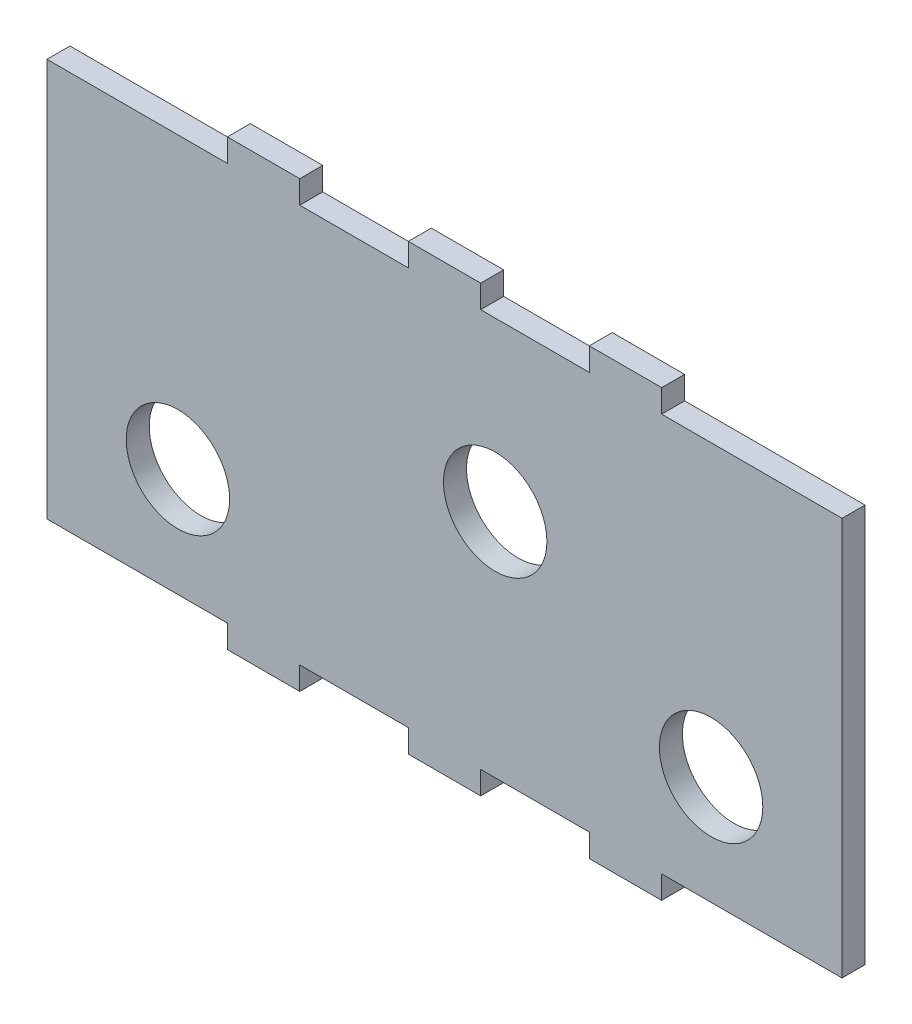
SolidWorks part; units mm, degrees
ref_plane "Front Plane" through (0, 0, 0) normal (0, 0, 1) x (1, 0, 0)
ref_plane "Top Plane" through (0, 0, 0) normal (0, 1, 0) x (1, 0, 0)
ref_plane "Right Plane" through (0, 0, 0) normal (1, 0, 0) x (0, 0, -1)
sketch "Sketch1" plane through (0, 0, 0) normal (0, 0, 1) x (1, 0, 0)
  line L0 (36.18, 30) -> (183.5, 30) construction
  line L5 (123.8464, 30) -> (183.5, 30) construction
  line L6 (123.8464, 63.6704) -> (123.8464, 30) construction
  line L7 (123.8464, 30) -> (36.18, 30) construction
  line L8 (21.8925, 0) -> (21.8925, 110) construction
  line L9 (0, 94.1504) -> (219.68, 94.1504) construction
  line L10 (197.7875, 0) -> (197.7875, 110) construction
  line L11 (109.84, 30) -> (109.84, 0) construction
  line L12 (99.84, 0) -> (99.84, -6.35)
  line L13 (0, 0) -> (219.68, 0) construction
  line L14 (0, 0) -> (0, 110)
  line L15 (0, 110) -> (219.68, 110) construction
  line L16 (219.68, 0) -> (219.68, 110)
  line L17 (99.84, -6.35) -> (119.84, -6.35)
  line L18 (119.84, -6.35) -> (119.84, 0)
  line L19 (99.84, 0) -> (69.84, 0)
  line L20 (69.84, 0) -> (69.84, -6.35)
  line L21 (69.84, -6.35) -> (49.84, -6.35)
  line L22 (49.84, -6.35) -> (49.84, 0)
  line L23 (49.84, 0) -> (0, 0)
  line L24 (119.84, 0) -> (149.84, 0)
  line L25 (149.84, 0) -> (149.84, -6.35)
  line L26 (149.84, -6.35) -> (169.84, -6.35)
  line L27 (169.84, -6.35) -> (169.84, 0)
  line L28 (169.84, 0) -> (219.68, 0)
  line L29 (0, 55) -> (219.68, 55) construction
  line L30 (169.84, 110) -> (219.68, 110)
  line L31 (169.84, 116.35) -> (169.84, 110)
  line L32 (149.84, 116.35) -> (169.84, 116.35)
  line L33 (149.84, 110) -> (149.84, 116.35)
  line L34 (119.84, 110) -> (149.84, 110)
  line L35 (119.84, 116.35) -> (119.84, 110)
  line L36 (99.84, 116.35) -> (119.84, 116.35)
  line L37 (99.84, 110) -> (99.84, 116.35)
  line L38 (99.84, 110) -> (69.84, 110)
  line L39 (69.84, 110) -> (69.84, 116.35)
  line L40 (69.84, 116.35) -> (49.84, 116.35)
  line L41 (49.84, 116.35) -> (49.84, 110)
  line L42 (49.84, 110) -> (0, 110)
  circle A0 centre (36.18, 30) radius 14.2875
  circle A1 centre (183.5, 30) radius 14.2875
  circle A2 centre (123.8464, 63.6704) radius 14.2875
  circle A3 centre (123.8464, 63.6704) radius 30.48 construction
  point P29 (109.84, -6.35)
  dimension "D2" = 28.575
  dimension "D3" = 93.91
  dimension "D4" = 60.96
  dimension "D9" = 110
  dimension "D10" = 20
  dimension "D1" = 68.5
  dimension "D5" = 49.84
  dimension "D6" = 30
  dimension "D7" = 147.32
  dimension "D8" = 49.84
  dimension "D11" = 30
  dimension "D12" = 6.35
  dimension "D13" = 122.7
  dimension "D14" = 219.68
extrude "Boss-Extrude1" add sketch "Sketch1" along normal blind 6.35
